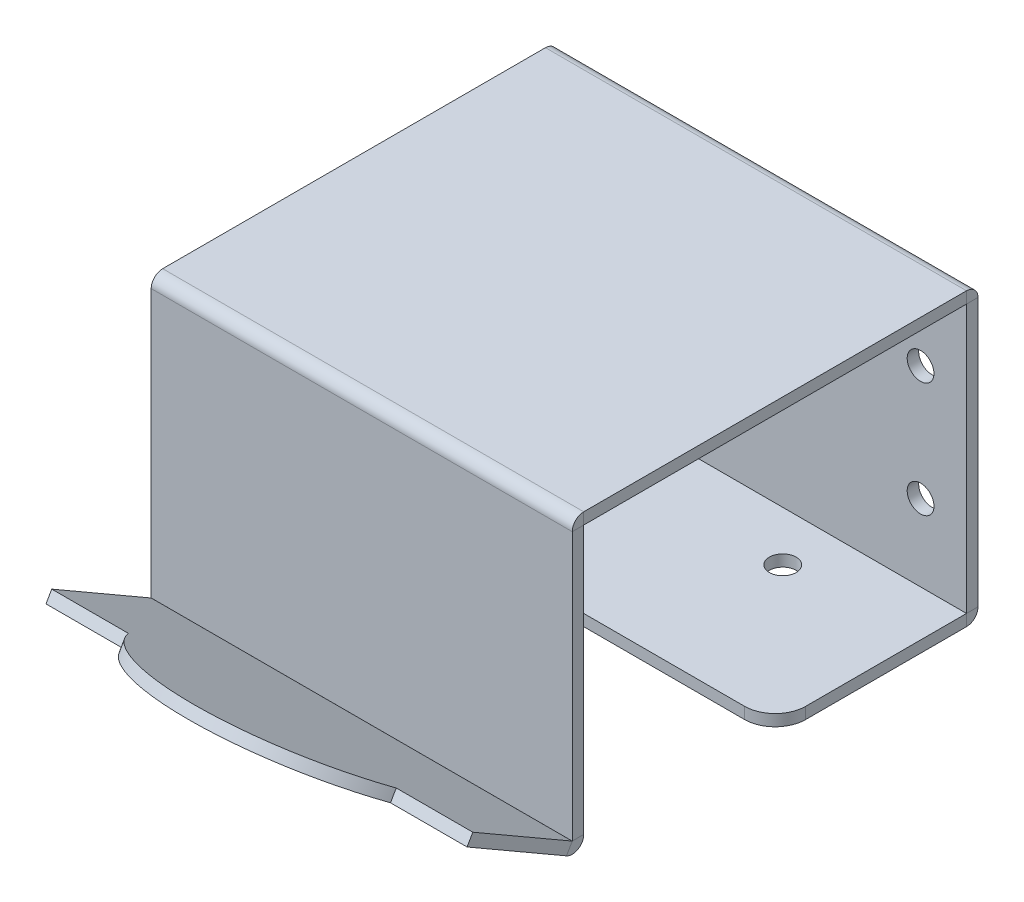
SolidWorks part; units mm, degrees
ref_plane "Front Plane" through (0, 0, 0) normal (0, 0, 1) x (1, 0, 0)
ref_plane "Top Plane" through (0, 0, 0) normal (0, 1, 0) x (1, 0, 0)
ref_plane "Right Plane" through (0, 0, 0) normal (1, 0, 0) x (0, 0, -1)
sketch "Sketch1" plane through (0, 0, 0) normal (0, 0, 1) x (1, 0, 0)
  line L0 (27.5, 0) -> (27.5, 160) construction
  line L1 (4, 0) -> (51, 0)
  line L2 (0, 4) -> (0, 160)
  line L3 (0, 160) -> (10, 160)
  line L4 (55, 4) -> (55, 160)
  line L5 (45, 160) -> (55, 160)
  arc A0 (45, 160) -> (10, 160) centre (27.5, 150.3175) ccw
  circle A1 centre (6, 50) radius 1.75
  circle A2 centre (6, 35) radius 1.75
  circle A3 centre (49, 50) radius 1.75
  circle A4 centre (49, 35) radius 1.75
  circle A5 centre (17.5, 18.5) radius 1.75
  circle A6 centre (37.5, 18.5) radius 1.75
  arc A7 (51, 0) -> (55, 4) centre (51, 4) ccw
  arc A8 (4, 0) -> (0, 4) centre (4, 4) cw
  point P24 (55, 0)
  point P27 (0, 0)
  dimension "D3" = 40
  dimension "D5" = 3.5
  dimension "D6" = 15
  dimension "D7" = 15
  dimension "D8" = 6
  dimension "D9" = 6
  dimension "D10" = 50
  dimension "D11" = 50
  dimension "D12" = 6
  dimension "D13" = 6
  dimension "D14" = 10
  dimension "D15" = 20
  dimension "D16" = 18.5
  dimension "D17" = 18.5
  dimension "D18" = 4
  dimension "D1" = 55
  dimension "D2" = 160
  dimension "D4" = 10
sheet metal parameters "Sheet-Metal1" thickness 1.5 parameters "D1"=1
base flange "Base-Flange1" sketch "Sketch1" thickness 1.5 reverse thickness direction yes parameters "D1"=1
sketch "Sketch3" plane through (0, 0, 1.5) normal (0, 0, 1) x (1, 0, 0)
  line L0 (0, 25) -> (55, 25)
  line L1 (0, 160) -> (0, 4) construction
  line L2 (55, 4) -> (55, 160) construction
  line L3 (0, 60) -> (55, 60)
  line L4 (0, 110) -> (55, 110)
  line L5 (4, 0) -> (51, 0) construction
  dimension "D1" = 25
  dimension "D2" = 35
  dimension "D3" = 50
sketched bend "Sketched Bend1" parameters "D1"=0
bend "SketchBend1" bend radius 0 bend angle 90 parameters "D5"=1
bend "SketchBend2" bend radius 0 bend angle 90 parameters "D5"=2
bend "SketchBend3" bend radius 0 bend angle 90 parameters "D5"=3
sketch "Sketch4" plane through (0, 0, 53) normal (0, 0, 1) x (1, 0, 0)
  line L0 (55, 25) -> (0, 25)
  line L1 (55, 60) -> (55, 10) construction
  line L2 (0, 10) -> (0, 60) construction
  line L3 (55, 10) -> (45, 10) construction
  dimension "D1" = 15
sketched bend "Sketched Bend2" parameters "D1"=0.001
bend "SketchBend4" bend radius 0.001 bend angle 120 parameters "D5"=4
flat pattern "Flat-Pattern1"
sketch "Bend-Lines1" plane through (0, 0, 0) normal (0, 1, 0) x (-1, 0, 0)
bend of the flat pattern "Flatten-<SketchBend1>1"
bend of the flat pattern "Flatten-<SketchBend2>1"
bend of the flat pattern "Flatten-<SketchBend3>1"
bend of the flat pattern "Flatten-<SketchBend4>1"
